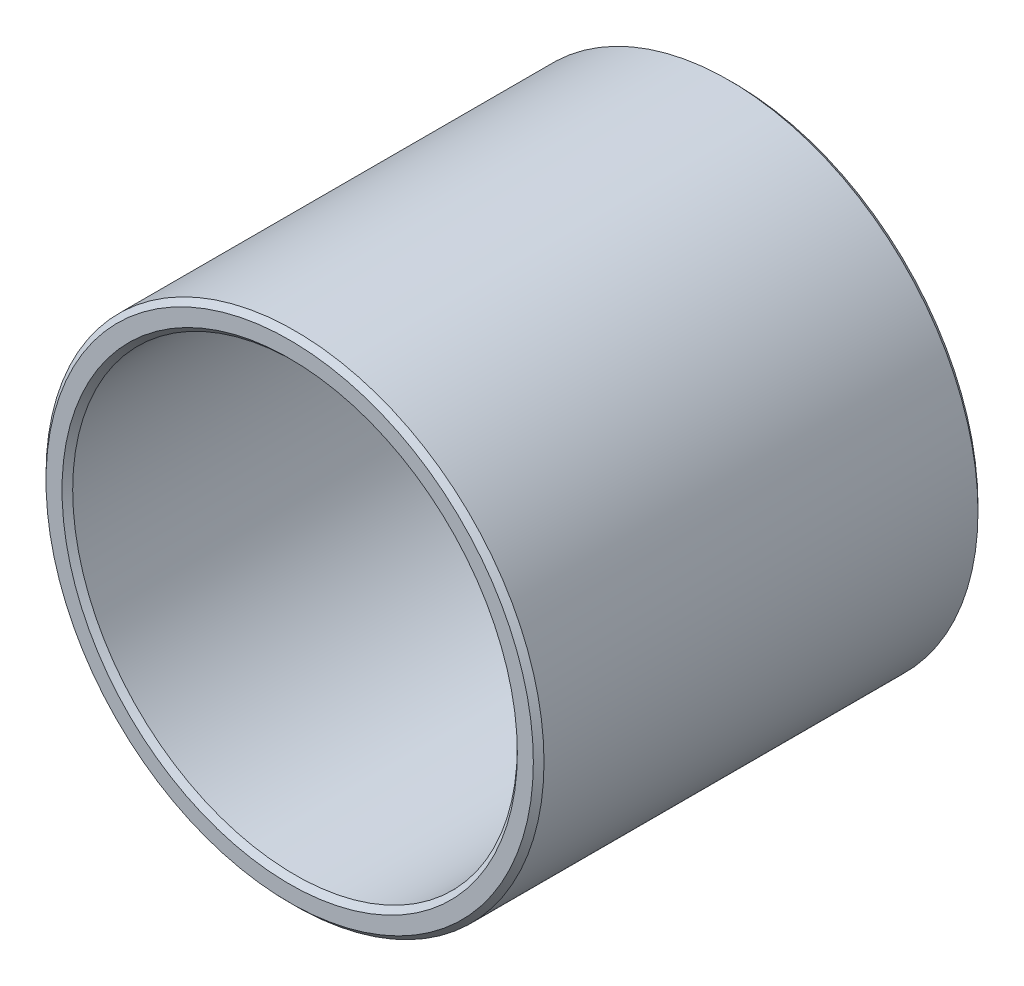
SolidWorks part; units mm, degrees
ref_plane "Face" through (0, 0, 0) normal (0, 0, 1) x (1, 0, 0)
ref_plane "Dessus" through (0, 0, 0) normal (0, 1, 0) x (1, 0, 0)
ref_plane "Droite" through (0, 0, 0) normal (1, 0, 0) x (0, 0, -1)
sketch "Esquisse1" plane through (0, 0, 0) normal (0, 0, 1) x (1, 0, 0)
  circle A0 centre (0, 0) radius 12.5
  circle A1 centre (0, 0) radius 14
  dimension "D1" = 25
  dimension "D2" = 28
extrude "Base-Extrusion" add sketch "Esquisse1" against normal blind 25
chamfer "Chanfrein1" distance 0.3 angle 45
